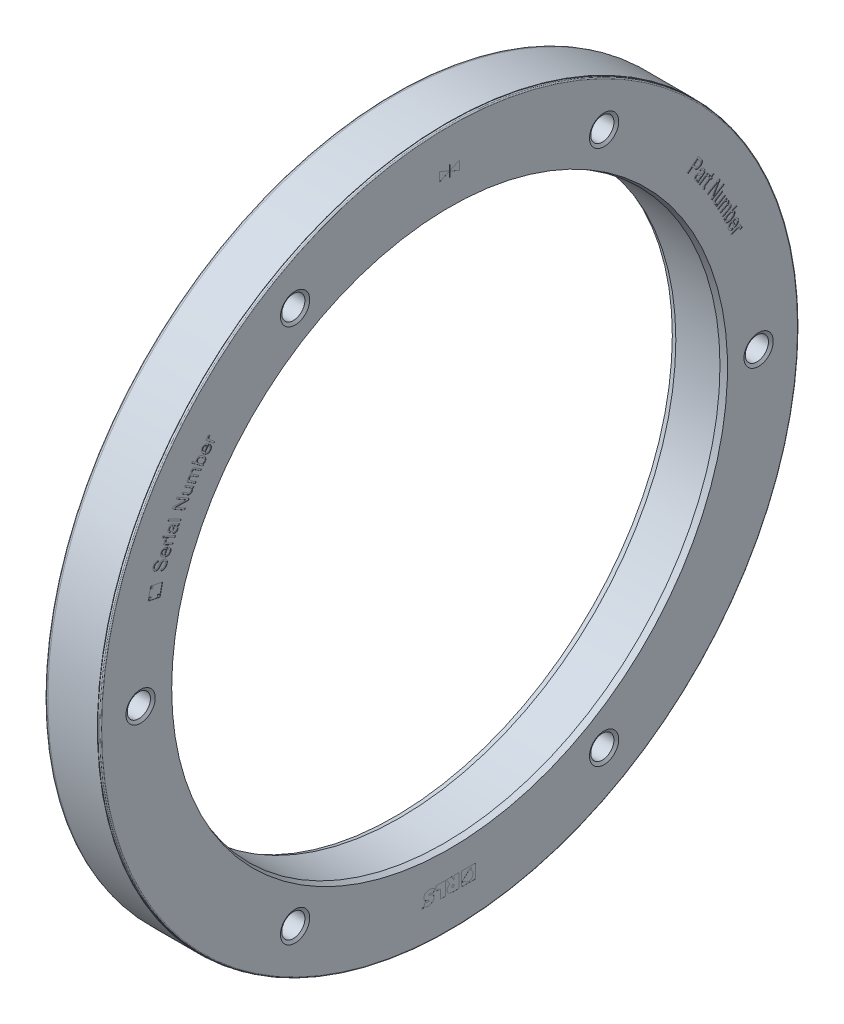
SolidWorks part; units mm, degrees
ref_plane "Front Plane" through (0, 0, 0) normal (0, 0, 1) x (1, 0, 0)
ref_plane "Top Plane" through (0, 0, 0) normal (0, 1, 0) x (1, 0, 0)
ref_plane "Right Plane" through (0, 0, 0) normal (1, 0, 0) x (0, 0, -1)
imported_body "U_prirobnica-1-solid1"
imported_body "Elastof_trak_zlepljen-1-solid1"
imported_body "folija_zavarjena-1-solid1"
other "Intersect1"
